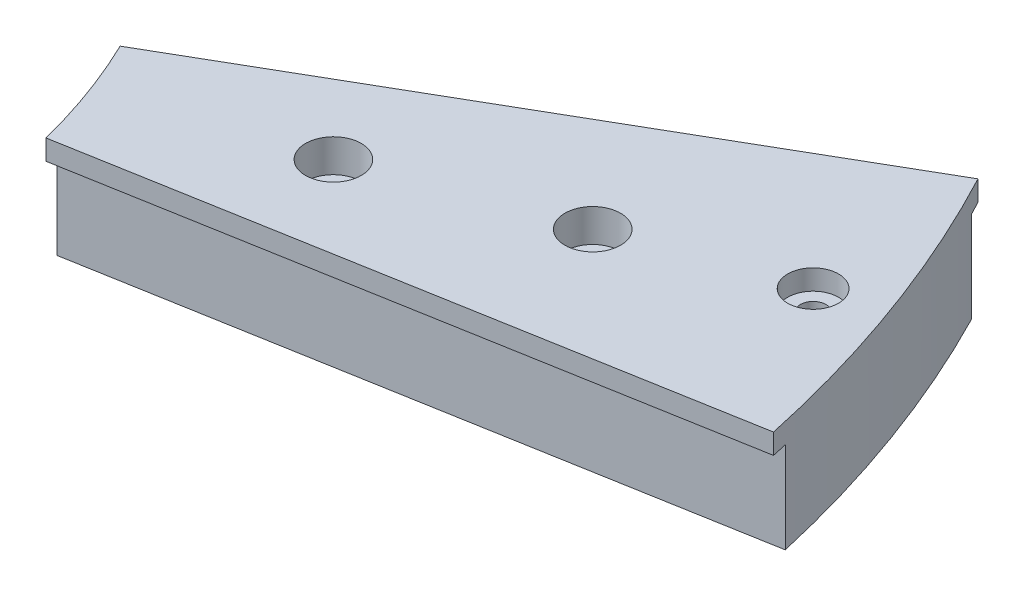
SolidWorks part; units mm, degrees
ref_plane "FRONT" through (0, 0, 0) normal (0, 0, 1) x (1, 0, 0)
ref_plane "TOP" through (0, 0, 0) normal (0, 1, 0) x (1, 0, 0)
ref_plane "RIGHT" through (0, 0, 0) normal (1, 0, 0) x (0, 0, -1)
sketch "Sketch1" plane through (0, 0, 0) normal (0, 1, 0) x (1, 0, 0)
  line L0 (0, 0) -> (192.296, 33.907) construction
  line L1 (0, 0) -> (169.1023, 97.6313) construction
  line L2 (0, 0) -> (195.2625, 0) construction
  line L3 (87.2071, 42.1002) -> (172.561, 91.3792)
  line L4 (93.866, 23.8051) -> (190.9268, 40.9195)
  arc A2 (93.866, 23.8051) -> (87.2071, 42.1002) centre (0, 0) ccw
  arc A3 (190.9268, 40.9195) -> (172.561, 91.3792) centre (0, 0) ccw
  dimension "D1" = 96.8375
  dimension "D2" = 195.2625
  dimension "D3" = 10
  dimension "D4" = 30
  dimension "D5" = 7.1437
  dimension "D6" = 7.1437
extrude "Base-Extrude" add sketch "Sketch1" along normal blind 17.4625
sketch "Sketch2" plane through (0, 0, 0) normal (0, 1, 0) x (1, 0, 0)
  line L0 (76.2, 32.9442) -> (200.025, 104.4346)
  line L1 (76.2, 23.1532) -> (200.025, 44.9869)
  line L2 (200.025, 44.9869) -> (200.025, 104.4346)
  line L3 (76.2, 23.1532) -> (76.2, 0)
  line L4 (76.2, 0) -> (228.6, 0)
  line L5 (228.6, 0) -> (228.6, 127)
  line L6 (228.6, 127) -> (76.2, 127)
  line L7 (76.2, 127) -> (76.2, 32.9442)
  line L9 (0, 0) -> (169.1023, 97.6313) construction
  line L10 (0, 0) -> (192.296, 33.907) construction
  line L11 (0, 0) -> (195.2625, 0) construction
  line L12 (-50, 0) -> (50, 0) construction
  line L13 (0, -50) -> (0, 50) construction
  dimension "D1" = 127
  dimension "D2" = 76.2
  dimension "D3" = 200.025
  dimension "D4" = 228.6
  dimension "D5" = 9.5694
  dimension "D6" = 9.5694
extrude "Cut-Extrude2" cut sketch "Sketch2" along normal blind 14.2875
sketch "HOLE LOC SKETCH" plane through (0, 0, 0) normal (0, -1, 0) x (1, 0, 0)
  line L0 (104.4233, -38.007) -> (174.5362, -63.526) construction
  line L1 (172.561, -91.3792) -> (87.2071, -42.1002) construction
  line L2 (93.866, -23.8051) -> (190.9268, -40.9195) construction
  line L3 (0, 0) -> (170.9723, -72.5734) construction
  line L4 (0, 0) -> (177.6217, -54.3044) construction
  arc A0 (170.9723, -72.5734) -> (177.6217, -54.3044) centre (0, 0) ccw construction
  arc A1 (102.2911, -43.42) -> (106.2694, -32.4898) centre (0, 0) ccw construction
  arc A2 (160.7432, -68.2314) -> (166.9947, -51.0554) centre (0, 0) ccw construction
  arc A3 (146.1301, -62.0286) -> (151.8134, -46.414) centre (0, 0) ccw construction
  arc A4 (116.9041, -49.6229) -> (121.4507, -37.1312) centre (0, 0) ccw construction
  dimension "D1" = 371.475
  dimension "D2" = 222.25
  dimension "D3" = 349.25
  dimension "D4" = 317.5
  dimension "D5" = 254
  dimension "D6" = 3
  dimension "D7" = 3
sketch "Sketch4" plane through (153.8115, 17.4625, -48.2881) normal (0, 1, 0) x (-1, 0, 0)
  line L0 (49.3882, 10.2811) -> (-20.7246, -15.2379) construction
  circle A0 centre (153.8115, 48.2881) radius 185.7375 construction
  point P0 (-20.7246, -15.2379)
sketch "Sketch5" plane through (174.5362, 17.4625, -63.526) normal (1, 0, 0) x (0, 0, 1)
  line L0 (0, 0) -> (0, 28.5183)
  line L1 (0, 28.5183) -> (2.0193, 27.305)
  line L2 (2.0193, 27.305) -> (2.0193, 3.175)
  line L3 (2.0193, 3.175) -> (3.9878, 3.175)
  line L4 (3.9878, 0) -> (0, 0)
  line L5 (0, -11.3109) -> (0, 121.1557) construction
  line L6 (0, 28.5183) -> (-2.0193, 27.305) construction
  line L7 (3.9878, 3.175) -> (3.9878, 0)
  dimension "Depth" = 27.305
  dimension "Drill Angle" = 118
  dimension "Diameter" = 4.0386
  dimension "C-Bore Diameter" = 7.9756
  dimension "C-Bore Depth" = 3.175
hole_wizard "TAPLOC.501" positions "Sketch4" profile "Sketch5" legacy
sketch "Sketch6" plane through (140.421, 17.4625, -55.347) normal (0, 1, 0) x (-1, 0, 0)
  line L0 (35.9977, 17.34) -> (-34.1151, -8.179) construction
  arc A0 (18.9703, 18.2158) -> (23.5169, 5.7241) centre (140.421, 55.347) ccw construction
  point P0 (21.0801, 11.9104)
sketch "Sketch7" plane through (119.341, 17.4625, -43.4366) normal (1, 0, 0) x (0, 0, 1)
  line L0 (0, 0) -> (0, 203.2)
  line L1 (0, 203.2) -> (2.8067, 203.2)
  line L2 (2.8067, 203.2) -> (2.8067, 5.1594)
  line L3 (2.8067, 5.1594) -> (4.3656, 5.1594)
  line L4 (4.3656, 5.1594) -> (4.3656, 0)
  line L5 (4.3656, 0) -> (0, 0)
  line L6 (0, 110) -> (0, -10) construction
  dimension "Diameter" = 5.6134
  dimension "Depth" = 203.2
  dimension "C-Bore Diameter" = 8.7312
  dimension "C-Bore Depth" = 5.1594
hole_wizard "CBORE10-OV1" positions "Sketch6" profile "Sketch7" legacy
sketch "Sketch8" plane through (164.0644, 17.4625, -66.0718) normal (0, 1, 0) x (-1, 0, 0)
  line L0 (59.641, 28.0648) -> (-10.4718, 2.5458) construction
  arc A0 (12.251, 19.6578) -> (17.9342, 4.0432) centre (164.0644, 66.0718) ccw construction
  point P0 (14.8882, 11.7761)
sketch "Sketch9" plane through (149.1762, 17.4625, -54.2957) normal (1, 0, 0) x (0, 0, 1)
  line L0 (0, 0) -> (0, 203.2)
  line L1 (0, 203.2) -> (2.8067, 203.2)
  line L2 (2.8067, 203.2) -> (2.8067, 5.1594)
  line L3 (2.8067, 5.1594) -> (4.3656, 5.1594)
  line L4 (4.3656, 5.1594) -> (4.3656, 0)
  line L5 (4.3656, 0) -> (0, 0)
  line L6 (0, 110) -> (0, -10) construction
  dimension "Diameter" = 5.6134
  dimension "Depth" = 203.2
  dimension "C-Bore Diameter" = 8.7312
  dimension "C-Bore Depth" = 5.1594
hole_wizard "CBORE10-OV2" positions "Sketch8" profile "Sketch9" legacy
sketch "Sketch10" plane through (105.0962, 0, -23.0965) normal (0, -1, 0) x (1, 0, 0)
  point P0 (-2.8051, -20.3235)
sketch "Sketch11" plane through (102.2911, 0, -43.42) normal (1, 0, 0) x (0, 0, -1)
  line L0 (0, 0) -> (0, 15.5991)
  line L1 (0, 15.5991) -> (2.1828, 14.2875)
  line L2 (2.1828, 14.2875) -> (2.1828, 7.1437)
  line L3 (2.1828, 7.1437) -> (2.394, 7.1437)
  line L4 (2.394, 0) -> (0, 0)
  line L5 (0, -11.3109) -> (0, 121.1557) construction
  line L6 (0, 15.5991) -> (-2.1828, 14.2875) construction
  line L7 (2.394, 7.1437) -> (2.394, 0)
  dimension "Depth" = 14.2875
  dimension "Drill Angle" = 118
  dimension "Diameter" = 4.3656
  dimension "C-Bore Diameter" = 4.7879
  dimension "C-Bore Depth" = 7.1437
hole_wizard "Hole3" positions "Sketch10" profile "Sketch11" legacy
sketch "Sketch12" plane through (132.5937, 0, -22.849) normal (0, -1, 0) x (1, 0, 0)
  line L0 (-30.3026, -18.177) -> (-30.3026, -22.9649)
  line L10 (-27.9086, -20.571) -> (-32.6965, -20.571)
  line L11 (-28.2294, -21.768) -> (-32.3758, -19.374)
  line L12 (-27.945, -20.9867) -> (-32.6602, -20.1553)
  line L13 (-28.053, -21.3898) -> (-32.5522, -19.7522)
  line L14 (-29.1056, -22.6442) -> (-31.4996, -18.4978)
  line L15 (-28.7638, -22.4049) -> (-31.8414, -18.7371)
  line L16 (-29.4838, -22.8206) -> (-31.1214, -18.3214)
  line L17 (-28.4687, -22.1098) -> (-32.1365, -19.0322)
  line L18 (-29.8869, -22.9286) -> (-30.7183, -18.2134)
  circle A0 centre (-30.3026, -20.571) radius 2.394
  dimension "D12" = 10
  dimension "D18" = 4.7879
  dimension "D1" = 10
  dimension "D10" = 10
  dimension "D11" = 10
  dimension "D13" = 10
  dimension "D14" = 10
  dimension "D15" = 10
  dimension "D16" = 10
  dimension "D17" = 10
other "SF_.18751"
sketch "Sketch13" plane through (179.8695, 0, -24.7959) normal (0, -1, 0) x (1, 0, 0)
  point P0 (-12.8748, -26.2595)
sketch "Sketch14" plane through (166.9947, 0, -51.0554) normal (1, 0, 0) x (0, 0, -1)
  line L0 (0, 0) -> (0, 15.5991)
  line L1 (0, 15.5991) -> (2.1828, 14.2875)
  line L2 (2.1828, 14.2875) -> (2.1828, 7.1437)
  line L3 (2.1828, 7.1437) -> (2.394, 7.1437)
  line L4 (2.394, 0) -> (0, 0)
  line L5 (0, -11.3109) -> (0, 121.1557) construction
  line L6 (0, 15.5991) -> (-2.1828, 14.2875) construction
  line L7 (2.394, 7.1437) -> (2.394, 0)
  dimension "Depth" = 14.2875
  dimension "Drill Angle" = 118
  dimension "Diameter" = 4.3656
  dimension "C-Bore Diameter" = 4.7879
  dimension "C-Bore Depth" = 7.1437
hole_wizard "Hole4" positions "Sketch13" profile "Sketch14" legacy
sketch "Sketch15" plane through (205.792, 0, -39.1464) normal (0, -1, 0) x (1, 0, 0)
  line L0 (-38.7973, -9.5151) -> (-38.7973, -14.303)
  line L10 (-36.4033, -11.909) -> (-41.1912, -11.909)
  line L11 (-36.7241, -13.106) -> (-40.8705, -10.712)
  line L12 (-36.4397, -12.3247) -> (-41.1549, -11.4933)
  line L13 (-36.5477, -12.7278) -> (-41.0469, -11.0902)
  line L14 (-37.6003, -13.9822) -> (-39.9943, -9.8358)
  line L15 (-37.2585, -13.7429) -> (-40.3361, -10.0751)
  line L16 (-37.9785, -14.1586) -> (-39.6161, -9.6594)
  line L17 (-36.9634, -13.4478) -> (-40.6312, -10.3702)
  line L18 (-38.3816, -14.2666) -> (-39.213, -9.5514)
  circle A0 centre (-38.7973, -11.909) radius 2.3939
  dimension "D12" = 10
  dimension "D18" = 4.7879
  dimension "D1" = 10
  dimension "D10" = 10
  dimension "D11" = 10
  dimension "D13" = 10
  dimension "D14" = 10
  dimension "D15" = 10
  dimension "D16" = 10
  dimension "D17" = 10
other "SF_.18752"
